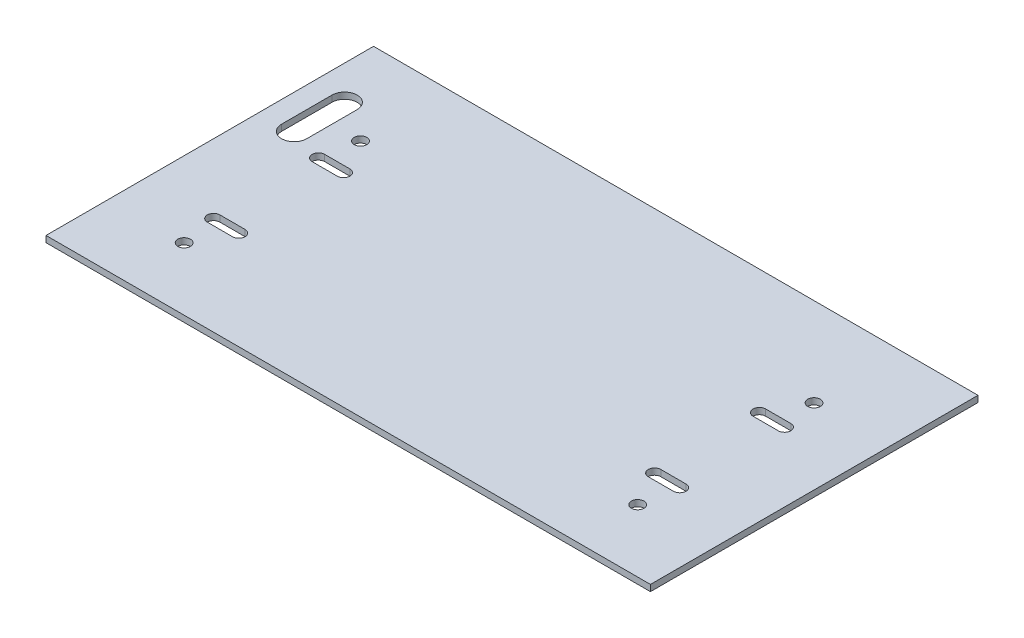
SolidWorks part; units mm, degrees
ref_plane "Front Plane" through (0, 0, 0) normal (0, 0, 1) x (1, 0, 0)
ref_plane "Top Plane" through (0, 0, 0) normal (0, 1, 0) x (1, 0, 0)
ref_plane "Right Plane" through (0, 0, 0) normal (1, 0, 0) x (0, 0, -1)
sketch "Sketch1" plane through (0, 402.2121, 0) normal (0, 1, 0) x (1, 0, 0)
  line L0 (-607.5404, -702.6158) -> (-607.5404, -1338.6392) construction
  line L1 (-912.2029, -1256.0892) -> (-607.5404, -1256.0892)
  line L2 (-912.2029, -1256.0892) -> (-912.2029, -1090.9892)
  line L3 (-912.2029, -1090.9892) -> (-607.5404, -1090.9892)
  line L4 (-607.5404, -1256.0892) -> (-607.5404, -1090.9892)
  circle A0 centre (-874.1716, -1135.6033) radius 3.175
  circle A1 centre (-645.5716, -1135.6033) radius 3.175
  circle A2 centre (-645.5716, -1224.5033) radius 3.175
  circle A3 centre (-874.1716, -1224.5033) radius 3.175
  dimension "D2" = 6.35
  dimension "D1" = 165.1
extrude "Boss-Extrude1" add sketch "Sketch1" along normal blind 3.175
sketch "Sketch2" plane through (0, 405.3871, 0) normal (0, 1, 0) x (1, 0, 0)
  line L0 (-895.0579, -1090.9892) -> (-895.0579, -1256.0892) construction
  line L1 (-607.5404, -1090.9892) -> (-912.2029, -1090.9892) construction
  line L2 (-912.2029, -1256.0892) -> (-607.5404, -1256.0892) construction
  line L3 (-895.0579, -1122.7392) -> (-895.0579, -1148.1392) construction
  line L4 (-888.7079, -1122.7392) -> (-888.7079, -1148.1392)
  line L5 (-901.4079, -1122.7392) -> (-901.4079, -1148.1392)
  line L6 (-912.2029, -1090.9892) -> (-912.2029, -1256.0892) construction
  arc A0 (-888.7079, -1122.7392) -> (-901.4079, -1122.7392) centre (-895.0579, -1122.7392) ccw
  arc A1 (-901.4079, -1148.1392) -> (-888.7079, -1148.1392) centre (-895.0579, -1148.1392) ccw
  point P8 (-895.0579, -1135.4392)
  dimension "D1" = 25.4
  dimension "D2" = 12.7
  dimension "D3" = 17.145
  dimension "D4" = 44.45
extrude "Cut-Extrude1" cut sketch "Sketch2" against normal through all
sketch "Sketch3" plane through (0, 405.3871, 0) normal (0, 1, 0) x (1, 0, 0)
  line L0 (-874.1716, -1135.6033) -> (-874.1716, -1224.5033) construction
  line L1 (-870.9966, -1153.6369) -> (-648.7466, -1153.6369) construction
  line L2 (-870.9966, -1153.6369) -> (-870.9966, -1206.4696) construction
  line L3 (-870.9966, -1206.4696) -> (-648.7466, -1206.4696) construction
  line L4 (-648.7466, -1153.6369) -> (-648.7466, -1206.4696) construction
  line L5 (-645.5716, -1135.6033) -> (-645.5716, -1224.5033) construction
  line L6 (-874.1716, -1180.0533) -> (-645.5716, -1180.0533) construction
  line L7 (-870.9966, -1153.6369) -> (-648.7466, -1153.6369) construction
  line L8 (-870.9966, -1153.6369) -> (-870.9966, -1206.4696) construction
  line L9 (-870.9966, -1206.4696) -> (-648.7466, -1206.4696) construction
  line L10 (-648.7466, -1153.6369) -> (-648.7466, -1206.4696) construction
  line L11 (-877.3466, -1153.6369) -> (-864.6466, -1153.6369) construction
  line L12 (-877.3466, -1150.4619) -> (-864.6466, -1150.4619)
  line L13 (-877.3466, -1156.8119) -> (-864.6466, -1156.8119)
  line L14 (-877.3466, -1206.4696) -> (-864.6466, -1206.4696) construction
  line L15 (-877.3466, -1203.2946) -> (-864.6466, -1203.2946)
  line L16 (-877.3466, -1209.6446) -> (-864.6466, -1209.6446)
  line L17 (-759.8716, -1153.6369) -> (-759.8716, -1206.4696) construction
  line L18 (-642.3966, -1153.6369) -> (-655.0966, -1153.6369) construction
  line L19 (-642.3966, -1150.4619) -> (-655.0966, -1150.4619)
  line L20 (-642.3966, -1156.8119) -> (-655.0966, -1156.8119)
  line L21 (-642.3966, -1206.4696) -> (-655.0966, -1206.4696) construction
  line L22 (-642.3966, -1203.2946) -> (-655.0966, -1203.2946)
  line L23 (-642.3966, -1209.6446) -> (-655.0966, -1209.6446)
  line L24 (-648.7466, -1153.6369) -> (-648.7466, -1206.4696) construction
  line L25 (-648.7466, -1153.6369) -> (-648.7466, -1206.4696) construction
  circle A5 centre (-870.9966, -1153.6369) radius 3.175 construction
  circle A6 centre (-870.9966, -1206.4696) radius 3.175 construction
  circle A7 centre (-648.7466, -1206.4696) radius 3.175 construction
  circle A8 centre (-648.7466, -1153.6369) radius 3.175 construction
  arc A9 (-877.3466, -1150.4619) -> (-877.3466, -1156.8119) centre (-877.3466, -1153.6369) ccw
  arc A10 (-864.6466, -1156.8119) -> (-864.6466, -1150.4619) centre (-864.6466, -1153.6369) ccw
  arc A11 (-877.3466, -1203.2946) -> (-877.3466, -1209.6446) centre (-877.3466, -1206.4696) ccw
  arc A12 (-864.6466, -1209.6446) -> (-864.6466, -1203.2946) centre (-864.6466, -1206.4696) ccw
  arc A13 (-642.3966, -1150.4619) -> (-642.3966, -1156.8119) centre (-642.3966, -1153.6369) cw
  arc A14 (-655.0966, -1156.8119) -> (-655.0966, -1150.4619) centre (-655.0966, -1153.6369) cw
  arc A15 (-642.3966, -1203.2946) -> (-642.3966, -1209.6446) centre (-642.3966, -1206.4696) cw
  arc A16 (-655.0966, -1209.6446) -> (-655.0966, -1203.2946) centre (-655.0966, -1206.4696) cw
  circle A17 centre (-648.7466, -1206.4696) radius 3.175 construction
  circle A18 centre (-648.7466, -1153.6369) radius 3.175 construction
  point P21 (-870.9966, -1180.0533)
  point P22 (-874.1716, -1180.0533)
  point P23 (-759.8716, -1206.4696)
  point P26 (-759.8716, -1180.0533)
  point P30 (-870.9966, -1153.6369)
  point P38 (-870.9966, -1206.4696)
  point P44 (-648.7466, -1153.6369)
  point P53 (-648.7466, -1206.4696)
  dimension "D1" = 6.35
  dimension "D2" = 3.175
  dimension "D4" = 3.175
  dimension "D3" = 12.7
  dimension "D5" = 12.7
extrude "Cut-Extrude2" cut sketch "Sketch3" against normal through all
